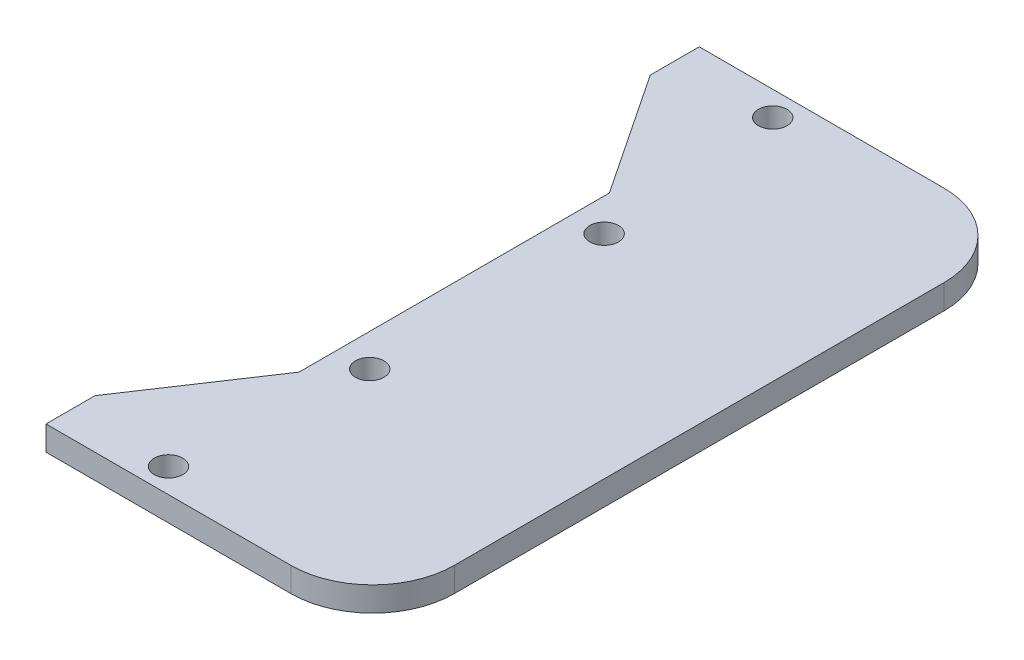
SolidWorks part; units mm, degrees
ref_plane "Front Plane" through (0, 0, 0) normal (0, 0, 1) x (1, 0, 0)
ref_plane "Top Plane" through (0, 0, 0) normal (0, 1, 0) x (1, 0, 0)
ref_plane "Right Plane" through (0, 0, 0) normal (1, 0, 0) x (0, 0, -1)
sketch "Sketch1" plane through (0, 0, 0) normal (0, 1, 0) x (1, 0, 0)
  line L0 (0, 0) -> (27057.8557, 0) construction
  line L1 (0, 19) -> (0, -19)
  line L2 (-10, 40) -> (-10, -32.1866) construction
  line L3 (-10, 40) -> (20, 40)
  line L4 (30, 30) -> (30, -30)
  line L5 (-10, 40) -> (-10, 34)
  line L6 (-10, 34) -> (0, 19)
  line L7 (-10, -40) -> (20, -40)
  line L8 (-10, -40) -> (-10, -34)
  line L9 (-10, -34) -> (0, -19)
  arc A0 (20, 40) -> (30, 30) centre (20, 30) cw
  circle A1 centre (2, 37) radius 1.75
  circle A2 centre (4, 14.355) radius 1.75
  arc A3 (20, -40) -> (30, -30) centre (20, -30) ccw
  circle A4 centre (2, -37) radius 1.75
  circle A5 centre (4, -14.355) radius 1.75
  point P6 (0, 0)
  point P13 (30, 40)
  point P20 (30, 0)
  dimension "D6" = 10
  dimension "D9" = 3.5
  dimension "D11" = 3.5
  dimension "D1" = 38
  dimension "D2" = 10
  dimension "D3" = 40
  dimension "D4" = 40
  dimension "D5" = 6
  dimension "D7" = 12
  dimension "D8" = 3
  dimension "D10" = 25.645
  dimension "D12" = 4
extrude "Boss-Extrude1" add sketch "Sketch1" along normal blind 3
